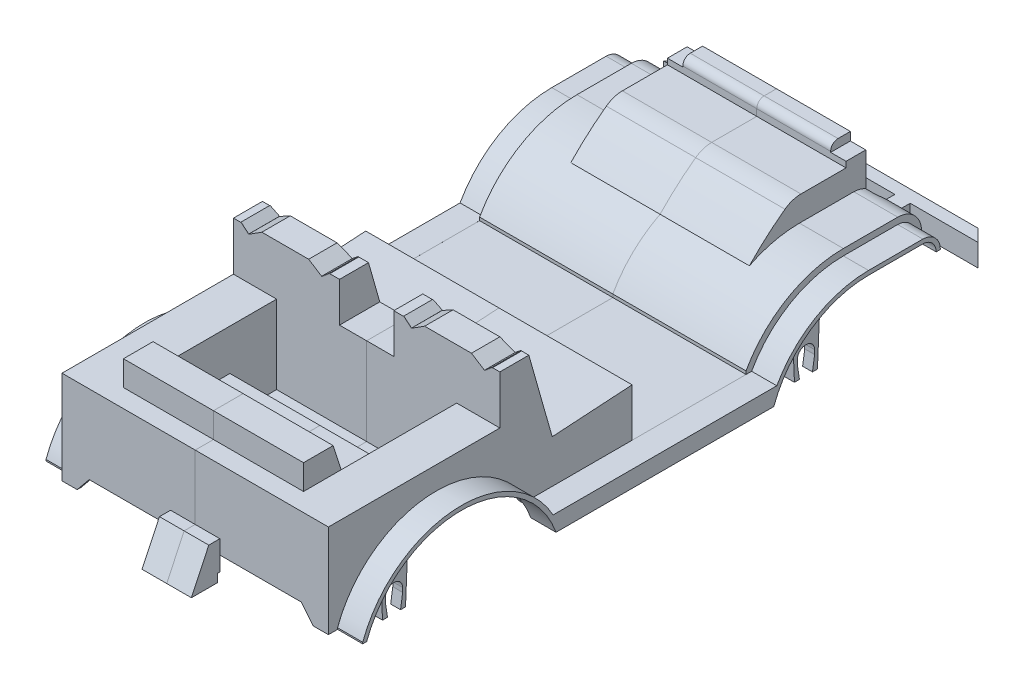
SolidWorks part; units mm, degrees
ref_plane "Alzado" through (0, 0, 0) normal (0, 0, 1) x (1, 0, 0)
ref_plane "Planta" through (0, 0, 0) normal (0, 1, 0) x (1, 0, 0)
ref_plane "Vista lateral" through (0, 0, 0) normal (1, 0, 0) x (0, 0, -1)
sketch "Croquis1" plane through (0, 0, 0) normal (1, 0, 0) x (0, 0, -1)
  line L0 (38.3851, 0) -> (126.683, 0)
  line L1 (165.066, 26.9) -> (186.9727, 26.9011)
  line L3 (-39.983, 0.5802) -> (-39.983, 0)
  line L4 (-39.983, 0) -> (-38.3851, 0)
  line L5 (165.066, 28.6) -> (187.0972, 28.6)
  line L6 (37.1955, 6.7) -> (127.8726, 6.7)
  line L10 (192.474, 21.4) -> (194.174, 21.4)
  arc A0 (-38.3851, 0) -> (38.3851, 0) centre (0, -13.9369) cw
  arc A1 (-39.983, 0.5802) -> (37.1955, 6.7) centre (0, -13.9369) cw
  arc A2 (-39.983, 0.5802) -> (39.983, 0.5802) centre (0, -13.9369) cw construction
  arc A3 (126.683, 0) -> (165.066, 26.9) centre (165.068, -13.9368) cw
  arc A4 (127.8726, 6.7) -> (165.066, 28.6) centre (165.068, -13.9368) cw
  arc A5 (192.474, 21.4) -> (186.9727, 26.9011) centre (186.9729, 21.4) ccw
  arc A6 (194.174, 21.4) -> (187.0972, 28.6) centre (186.9729, 21.4) ccw
  arc A7 (125.0851, 0.5802) -> (205.0509, 0.5802) centre (165.068, -13.9368) cw construction
  arc A8 (194.174, 21.4) -> (186.9726, 28.6011) centre (186.9729, 21.4) ccw construction
  arc A9 (126.683, 0) -> (203.453, 0) centre (165.068, -13.9368) cw construction
  dimension "D1" = 1.7
  dimension "D2" = 1.7
extrude "Extruir1" add sketch "Croquis1" against normal blind 10.2
sketch "Croquis2" plane through (-10.2, 0, 0) normal (-1, 0, 0) x (0, 0, 1)
  line L0 (39.983, 0) -> (43.683, 0)
  line L1 (-79.4171, 6.7) -> (-37.1955, 6.7)
  line L2 (43.683, 0) -> (43.683, 37.8)
  line L3 (43.683, 37.8) -> (-25.817, 37.8)
  line L4 (-25.817, 37.8) -> (-25.817, 58.3)
  line L5 (39.983, 0.5802) -> (39.983, 0) construction
  line L6 (-127.8726, 6.7) -> (-37.1955, 6.7) construction
  line L7 (-79.4171, 6.7) -> (-79.4171, 26.15)
  line L8 (39.983, 0.5802) -> (39.983, 0)
  line L9 (-25.817, 58.3) -> (-37.317, 58.3)
  line L10 (-37.317, 58.3) -> (-47.017, 24.12)
  line L11 (-79.4171, 26.15) -> (-47.017, 24.12)
  arc A0 (39.983, 0.5802) -> (-37.1955, 6.7) centre (0, -13.9369) ccw construction
  arc A1 (39.983, 0.5802) -> (-37.1955, 6.7) centre (0, -13.9369) ccw
sketch "Croquis11" plane through (-10.2, 0, 0) normal (-1, 0, 0) x (0, 0, 1)
  line L20 (-79.4271, 6.69) -> (-79.4271, 26.1606)
  line L21 (-79.4271, 26.1606) -> (-47.0244, 24.1305)
  line L22 (-37.3246, 58.31) -> (-47.0244, 24.1305)
  line L23 (-25.807, 58.31) -> (-37.3246, 58.31)
  line L24 (-25.807, 37.81) -> (-25.807, 58.31)
  line L25 (43.693, 37.81) -> (-25.807, 37.81)
  line L26 (43.693, 6.7) -> (43.693, 37.81)
  line L27 (43.693, -0.01) -> (43.693, 6.7)
  line L28 (39.973, -0.01) -> (43.693, -0.01)
  line L29 (39.973, 0.5784) -> (39.973, -0.01)
  line L30 (-79.4271, 6.69) -> (37.1896, 6.69)
  arc A2 (39.973, 0.5784) -> (37.1896, 6.69) centre (0, -13.9369) ccw
extrude "Extruir14" add sketch "Croquis11" along normal blind 54 separate body
shell "Vaciado4" thickness 1.7
sketch "Croquis14" plane through (-62.5, 0, 0) normal (1, 0, 0) x (0, 0, -1)
  line L10 (-37.1896, 6.69) -> (77.7271, 6.69)
  line L11 (77.7271, 6.69) -> (77.7271, 24.3508)
  line L12 (77.7271, 24.3508) -> (45.7631, 22.3481)
  line L13 (45.7631, 22.3481) -> (36.0399, 56.61)
  line L14 (36.0399, 56.61) -> (27.507, 56.61)
  line L15 (27.507, 56.61) -> (27.507, 36.11)
  line L16 (27.507, 36.11) -> (-41.993, 36.11)
  line L17 (-41.993, 36.11) -> (-41.993, 1.69)
  line L18 (-41.993, 1.69) -> (-41.3741, 1.69)
  line L19 (-39.1222, 6.69) -> (-37.1896, 6.69)
  line L20 (-37.1896, 6.69) -> (77.7271, 6.69)
  line L21 (77.7271, 6.69) -> (77.7271, 24.3508)
  line L22 (77.7271, 24.3508) -> (45.7631, 22.3481)
  line L23 (45.7631, 22.3481) -> (36.0399, 56.61)
  line L24 (36.0399, 56.61) -> (27.507, 56.61)
  line L25 (27.507, 56.61) -> (27.507, 36.11)
  line L26 (27.507, 36.11) -> (-41.993, 36.11)
  line L27 (-41.993, 36.11) -> (-41.993, 1.69)
  line L28 (-41.993, 1.69) -> (-41.3741, 1.69)
  line L29 (-39.1222, 6.69) -> (-37.1896, 6.69)
  arc A1 (-39.1222, 6.69) -> (-41.3741, 1.69) centre (0, -13.9369) ccw
  arc A2 (-39.1222, 6.69) -> (-41.3741, 1.69) centre (0, -13.9369) ccw
  dimension "D1" = 0
extrude "Cortar-Extruir1" cut sketch "Croquis14" against normal blind 54
sketch "Croquis16" plane through (-10.2, 0, 0) normal (1, 0, 0) x (0, 0, -1)
  line L0 (-38.3851, 0) -> (38.3851, 0)
  arc A0 (38.3851, 0) -> (-38.3851, 0) centre (0, -13.9369) ccw construction
  arc A1 (38.3851, 0) -> (-38.3851, 0) centre (0, -13.9369) ccw
extrude "Cortar-Extruir2" cut sketch "Croquis16" against normal blind 54
sketch "Croquis17" plane through (0, 36.11, 0) normal (0, -1, 0) x (1, 0, 0)
  line L4 (-26.9062, 21.973) -> (-64.2, 21.973)
  line L5 (-64.2, 41.993) -> (-64.2, -27.507) construction
  line L6 (-64.2, 21.973) -> (-64.2, -27.507)
  line L7 (-64.2, -27.507) -> (-26.9062, -27.507)
  line L8 (-64.2, -27.507) -> (-11.9, -27.507) construction
  line L9 (-26.9062, -27.507) -> (-26.9062, 21.973)
extrude "Extruir15" add sketch "Croquis17" along normal blind 31
sketch "Croquis18" plane through (-26.9062, 0, 0) normal (1, 0, 0) x (0, 0, -1)
  line L1 (27.507, 5.11) -> (-21.973, 5.11) construction
  line L3 (-21.973, 5.11) -> (-21.973, 36.11) construction
  line L4 (-21.973, 19.4172) -> (5.4562, 19.4172)
  line L5 (5.4562, 19.4172) -> (5.4562, 5.11)
  line L6 (5.4562, 5.11) -> (5.4562, -2.3764)
  line L7 (5.4562, -2.3764) -> (-21.973, -2.3764)
  line L8 (-21.973, 19.4172) -> (-21.973, -2.3764)
extrude "Cortar-Extruir3" cut sketch "Croquis18" against normal blind 70.9148
sketch "Croquis19" plane through (0, 37.81, 0) normal (0, 1, 0) x (-1, 0, 0)
  line L0 (27.9062, -5.4562) -> (64.2, -5.4562)
  line L1 (64.2, -5.4562) -> (64.2, 20.973)
  line L2 (27.9062, 20.973) -> (27.9062, -5.4562)
  line L4 (64.2, 20.973) -> (27.9062, 20.973)
sketch "Croquis20" plane through (-64.2, 0, 0) normal (-1, 0, 0) x (0, 0, 1)
  line L0 (41.993, 1.69) -> (41.993, -0.5673)
  line L1 (41.993, -0.5673) -> (38.166, -0.5673)
  line L2 (38.166, -0.5673) -> (36.4301, -0.5673)
  line L3 (36.4301, -0.5673) -> (36.4301, 9.2353)
  line L4 (36.4301, 9.2353) -> (41.993, 9.2353)
  line L5 (41.993, 1.69) -> (41.993, 36.11) construction
  line L6 (41.993, 9.2353) -> (41.993, 1.69)
  line L7 (-25.807, 37.81) -> (-25.807, 6.0432)
  line L8 (-25.807, 6.0432) -> (-8.6045, 6.0432)
  line L9 (-8.6045, 6.0432) -> (-6.8763, 6.0432)
  line L10 (-6.8763, 6.0432) -> (-6.8763, 19.7607)
  line L11 (-6.8763, 19.7607) -> (-6.8763, 21.1649)
  line L12 (-6.8763, 21.1649) -> (15.5901, 21.1649)
  line L13 (15.5901, 21.1649) -> (20.995, 37.81)
  line L14 (43.693, 37.81) -> (-25.807, 37.81) construction
  line L15 (20.995, 37.81) -> (20.995, 43.4476)
  line L16 (20.995, 43.4476) -> (-25.807, 43.4476)
  line L17 (-25.807, 37.81) -> (-25.807, 58.31) construction
  line L18 (-25.807, 43.4476) -> (-25.807, 37.81)
extrude "Cortar-Extruir6" cut sketch "Croquis20" against normal blind 36.5
sketch "Croquis21" plane through (-27.7, 0, 0) normal (-1, 0, 0) x (0, 0, 1)
  line L5 (41.993, -0.01) -> (41.993, 1.69)
  line L6 (41.993, 1.69) -> (41.3741, 1.69)
  line L7 (39.1222, 6.69) -> (37.1896, 6.69)
  line L8 (39.973, 0.5784) -> (39.973, -0.01)
  line L9 (39.973, -0.01) -> (41.993, -0.01)
  line L10 (41.993, -0.01) -> (41.993, 1.69)
  line L11 (41.993, 1.69) -> (41.3741, 1.69)
  line L12 (39.1222, 6.69) -> (37.1896, 6.69)
  line L13 (39.973, 0.5784) -> (39.973, -0.01)
  line L14 (39.973, -0.01) -> (41.993, -0.01)
  arc A2 (41.3741, 1.69) -> (39.1222, 6.69) centre (0, -13.9369) ccw
  arc A3 (39.973, 0.5784) -> (37.1896, 6.69) centre (0, -13.9369) ccw
  arc A4 (41.3741, 1.69) -> (39.1222, 6.69) centre (0, -13.9369) ccw
  arc A5 (39.973, 0.5784) -> (37.1896, 6.69) centre (0, -13.9369) ccw
  dimension "D1" = 0
extrude "Cortar-Extruir7" cut sketch "Croquis21" against normal up to vertex
sketch "Croquis22" plane through (0, 19.4172, 0) normal (0, -1, 0) x (1, 0, 0)
  line L0 (-26.9062, -5.4562) -> (-26.9062, 6.2438)
  line L1 (-26.9062, -5.4562) -> (-26.9062, 21.973) construction
  line L2 (-26.9062, 6.2438) -> (-30.9062, 6.2438)
  line L3 (-30.9062, 6.2438) -> (-30.9062, -5.4562)
  line L4 (-64.2, -5.4562) -> (-26.9062, -5.4562) construction
  line L5 (-30.9062, -5.4562) -> (-26.9062, -5.4562)
extrude "Extruir16" add sketch "Croquis22" along normal blind 42
sketch "Croquis23" plane through (0, 19.4172, 0) normal (0, -1, 0) x (1, 0, 0)
  line L0 (-30.9062, -0.7328) -> (-30.9062, 1.5203)
  line L1 (-30.9062, 6.2438) -> (-30.9062, -5.4562) construction
  line L3 (-38.0913, 1.5203) -> (-30.9062, 1.5203)
  line L6 (-38.0913, -0.7328) -> (-30.9062, -0.7328)
  arc A0 (-38.0913, 1.5203) -> (-38.0913, -0.7328) centre (-41.4265, 0.3938) ccw
extrude "Extruir17" add sketch "Croquis23" along normal up to vertex
sketch "Croquis24" plane through (0, 5.11, 0) normal (0, -1, 0) x (1, 0, 0)
  line L0 (-38.0913, -0.7328) -> (-30.9062, -0.7328) construction
  line L1 (-38.0913, -0.7328) -> (-30.9062, -0.7328)
  line L2 (-30.9062, 1.5203) -> (-38.0913, 1.5203) construction
  line L3 (-30.9062, 1.5203) -> (-38.0913, 1.5203)
  line L4 (-30.9062, -0.7328) -> (-30.9062, 1.5203)
  arc A0 (-38.0913, 1.5203) -> (-38.0913, -0.7328) centre (-37.7548, 0.3938) ccw
extrude "Extruir18" add sketch "Croquis24" along normal blind 9
sketch "Croquis25" plane through (-26.9062, 0, 0) normal (1, 0, 0) x (0, 0, -1)
  line L0 (4.2703, -22.5828) -> (5.4562, 5.11)
  line L1 (5.4562, -22.5828) -> (-6.2438, -22.5828) construction
  line L2 (-3.8938, -16.9222) -> (-3.037, -22.5828)
  line L3 (-5.0579, -22.5828) -> (-6.2438, 5.11)
  line L4 (5.4562, 5.11) -> (10.7771, -24.2142)
  line L5 (10.7771, -24.2142) -> (4.8633, -25.2872)
  line L6 (4.8633, -25.2872) -> (4.2703, -22.5828)
  line L7 (-6.2438, 5.11) -> (-11.6061, -25.2872)
  line L8 (-11.6061, -25.2872) -> (-6.2438, -25.2872)
  line L9 (-6.2438, -25.2872) -> (-5.0579, -22.5828)
  line L11 (3.1062, -15.1828) -> (3.1062, -16.9222)
  line L12 (-3.8938, -15.1828) -> (-3.8938, -16.9222)
  line L13 (-3.037, -23.3879) -> (2.2494, -23.3879)
  line L15 (3.1062, -16.9222) -> (2.2494, -22.5828)
  line L16 (2.2494, -22.5828) -> (2.2494, -23.3879)
  line L17 (-3.037, -22.5828) -> (-3.037, -23.3879)
  arc A0 (3.1062, -15.1828) -> (-3.8938, -15.1828) centre (-0.3938, -15.1828) ccw
extrude "Cortar-Extruir8" cut sketch "Croquis25" against normal blind 9
sketch "Croquis26" plane through (0, 19.4047, 1.2158) normal (0, -0.998, -0.0625) x (1, 0, 0)
  line L2 (-41.2, -63.0844) -> (-41.2, -77.9934)
  line L3 (-64.2, -77.9934) -> (-11.9, -77.9934) construction
  line L4 (-41.2, -77.9934) -> (-64.2, -77.9934)
  line L5 (-64.2, -77.9934) -> (-64.2, -27.7727)
  line L6 (-64.2, -27.7727) -> (-41.2, -27.7727)
  line L7 (-64.2, -27.7727) -> (-26.9062, -27.7727) construction
  line L8 (-41.2, -27.7727) -> (-41.2, -63.0844)
sketch "Croquis27" plane through (-64.2, 0, 0) normal (-1, 0, 0) x (0, 0, 1)
  line L0 (-45.7631, 22.3481) -> (-27.507, 22.3481)
  line L1 (-27.507, 5.11) -> (-27.507, 56.61) construction
  line L2 (-27.507, 22.3481) -> (-27.507, 56.61)
  line L3 (-27.507, 56.61) -> (-36.0399, 56.61)
  line L4 (-36.0399, 56.61) -> (-45.7631, 22.3481)
extrude "Extruir21" add sketch "Croquis27" against normal blind 11.1
sketch "Croquis28" plane through (0, 22.3481, 0) normal (0, -1, 0) x (1, 0, 0)
  line L0 (-64.2, -27.507) -> (-64.2, -28.4123)
  line L1 (-64.2, -45.7631) -> (-64.2, -27.507) construction
  line L2 (-64.2, -28.4123) -> (-53.1, -28.4123)
  line L3 (-53.1, -45.7631) -> (-53.1, -27.507) construction
  line L4 (-53.1, -28.4123) -> (-53.1, -27.507)
  line L5 (-64.2, -27.507) -> (-26.9062, -27.507) construction
  line L6 (-53.1, -27.507) -> (-64.2, -27.507)
extrude "Extruir22" add sketch "Croquis28" along normal up to vertex
sketch "Croquis29" plane through (-64.2, 0, 0) normal (-1, 0, 0) x (0, 0, 1)
  line L0 (20.995, 37.81) -> (36.2862, 37.81)
  line L1 (43.693, 37.81) -> (20.995, 37.81) construction
  line L2 (20.995, 37.81) -> (24.2805, 47.9281)
  line L3 (24.2805, 47.9281) -> (36.2862, 47.9281)
  line L4 (36.2862, 47.9281) -> (36.2862, 37.81)
extrude "Extruir23" add sketch "Croquis29" against normal up to vertex
sketch "Croquis31" plane through (-64.2, 0, 0) normal (-1, 0, 0) x (0, 0, 1)
  line L3 (16.5412, 20.856) -> (25.2316, 47.6193)
  line L4 (16.5412, 20.856) -> (25.0071, 46.9281)
  line L6 (36.2862, 46.9281) -> (24.2805, 46.9281)
  line L7 (35.2862, 46.9281) -> (25.0071, 46.9281)
  line L9 (35.2862, 37.81) -> (35.2862, 47.9281)
  line L10 (35.2862, 37.81) -> (35.2862, 46.9281)
  line L11 (35.2862, 20.856) -> (35.2862, 37.81)
  line L12 (16.5412, 20.856) -> (16.5412, 17.8954)
  line L13 (16.5412, 17.8954) -> (35.2862, 17.8954)
  line L14 (35.2862, 17.8954) -> (35.2862, 20.856)
  dimension "D1" = 1
  dimension "D2" = 1
  dimension "D3" = 1
extrude "Cortar-Extruir9" cut sketch "Croquis31" against normal blind 36.0957
sketch "Croquis32" plane through (-28.1043, 0, 0) normal (-1, 0, 0) x (0, 0, 1)
  line L0 (21.973, 36.11) -> (21.4944, 36.11)
  line L1 (25.0071, 46.9281) -> (16.5412, 20.856) construction
  line L2 (21.4944, 36.11) -> (16.5412, 20.856)
  line L3 (16.5412, 20.856) -> (16.5412, 19.4172) construction
  line L4 (16.5412, 20.856) -> (16.5412, 18.2909)
  line L5 (16.5412, 18.2909) -> (21.973, 18.2909)
  line L6 (21.973, 18.2909) -> (21.973, 36.11)
extrude "Cortar-Extruir10" cut sketch "Croquis32" against normal blind 7.1
sketch "Croquis33" plane through (-10.2, 0, 0) normal (-1, 0, 0) x (0, 0, 1)
  line L0 (-79.4271, 6.69) -> (-79.4271, 6.0743)
  line L1 (-79.4271, 6.0743) -> (-127.8726, 6.0743)
  line L2 (-127.8726, 6.0743) -> (-127.8726, 6.7)
  line L3 (-127.8726, 6.7) -> (-79.4271, 6.69)
extrude "Extruir25" add sketch "Croquis33" along normal up to vertex separate body
sketch "Croquis34" plane through (0, 6.0743, 0) normal (0, -1, 0) x (1, 0, 0)
  line L0 (-52.0158, -77.7271) -> (-52.0158, -76.7271)
  line L1 (-64.2, -77.7271) -> (-11.9, -77.7271) construction
  line L2 (-52.0158, -76.7271) -> (-56.7006, -76.7271)
  line L3 (-56.7006, -76.7271) -> (-56.7006, -77.7271)
  line L4 (-56.7006, -77.7271) -> (-52.0158, -77.7271)
extrude "Extruir26" add sketch "Croquis34" against normal up to vertex
sketch "Croquis35" plane through (-10.2, 0, 0) normal (-1, 0, 0) x (0, 0, 1)
  line L0 (-127.8726, 6.0743) -> (-129.4703, 6.0743)
  line L1 (-127.8726, 6.0743) -> (-127.8726, 6.7)
  line L2 (-187.0972, 28.6) -> (-165.066, 28.6) construction
  line L3 (-187.0972, 28.6) -> (-165.066, 28.6)
  line L4 (-192.474, 21.4) -> (-194.174, 21.4) construction
  line L5 (-192.474, 21.4) -> (-194.174, 21.4)
  line L6 (-165.066, 26.9) -> (-186.9727, 26.9011) construction
  line L7 (-165.066, 26.9) -> (-186.9727, 26.9011)
  arc A0 (-127.8726, 6.7) -> (-165.066, 28.6) centre (-165.068, -13.9368) ccw construction
  arc A1 (-127.8726, 6.7) -> (-165.066, 28.6) centre (-165.068, -13.9368) ccw
  arc A2 (-187.0972, 28.6) -> (-194.174, 21.4) centre (-186.9729, 21.4) ccw construction
  arc A3 (-187.0972, 28.6) -> (-194.174, 21.4) centre (-186.9729, 21.4) ccw
  arc A4 (-186.9727, 26.9011) -> (-192.474, 21.4) centre (-186.9729, 21.4) ccw construction
  arc A5 (-186.9727, 26.9011) -> (-192.474, 21.4) centre (-186.9729, 21.4) ccw
  arc A7 (-126.683, 0) -> (-165.066, 26.9) centre (-165.068, -13.9368) ccw construction
  arc A8 (-129.4703, 6.0743) -> (-165.066, 26.9) centre (-165.068, -13.9368) ccw
extrude "Extruir27" add sketch "Croquis35" along normal up to vertex
sketch "Croquis36" plane through (-64.2, 0, 0) normal (-1, 0, 0) x (0, 0, 1)
  line L0 (-165.066, 28.6) -> (-187.0972, 28.6) construction
  line L1 (-165.066, 28.6) -> (-187.0972, 28.6)
  line L2 (-165.0659, 31.2) -> (-187.1179, 31.2)
  line L3 (-196.774, 21.4) -> (-194.174, 21.4)
  line L4 (-125.599, 7.9614) -> (-125.599, 6.6995)
  line L5 (-79.4271, 6.69) -> (-127.8726, 6.7) construction
  line L6 (-127.8726, 6.7) -> (-125.599, 6.6995)
  arc A0 (-187.0972, 28.6) -> (-194.174, 21.4) centre (-186.9729, 21.4) ccw construction
  arc A1 (-187.0972, 28.6) -> (-194.174, 21.4) centre (-186.9729, 21.4) ccw
  arc A2 (-127.8726, 6.7) -> (-165.066, 28.6) centre (-165.068, -13.9368) ccw construction
  arc A3 (-127.8726, 6.7) -> (-165.066, 28.6) centre (-165.068, -13.9368) ccw
  arc A4 (-125.599, 7.9614) -> (-165.0659, 31.2) centre (-165.068, -13.9368) ccw
  arc A5 (-187.1179, 31.2) -> (-196.774, 21.4) centre (-186.9729, 21.4) ccw
  dimension "D1" = 2.6
extrude "Extruir28" add sketch "Croquis36" against normal up to vertex
sketch "Croquis37" plane through (0, 31.2, 0) normal (0, 1, 0) x (-1, 0, 0)
  line L1 (10.2, -196.774) -> (64.2, -196.774) construction
  line L2 (20.8, -196.774) -> (20.8, -195.9459)
  line L3 (24.8, -191.9459) -> (69.817, -191.9459)
  line L4 (69.817, -191.9459) -> (69.817, -201.0517)
  line L5 (69.817, -201.0517) -> (20.8, -201.0517)
  line L6 (20.8, -201.0517) -> (20.8, -196.774)
  arc A0 (24.8, -191.9459) -> (20.8, -195.9459) centre (24.8, -195.9459) ccw
  dimension "D1" = 4
extrude "Cortar-Extruir11" cut sketch "Croquis37" against normal blind 50.1
ref_plane "Plano1" through (-28, 0, 0) normal (1, 0, 0) x (0, 0, -1)
sketch "Croquis38" plane through (-28, 0, 0) normal (1, 0, 0) x (0, 0, -1)
  line L0 (191.9459, 29.8457) -> (191.9459, 46.8457)
  line L1 (191.9459, 46.8457) -> (183.9459, 46.8457)
  line L2 (183.9459, 46.8457) -> (183.9459, 41.1457)
  line L3 (183.9459, 41.1457) -> (165.6743, 41.1457)
  line L4 (165.0659, 31.2) -> (187.1179, 31.2) construction
  line L5 (165.0659, 31.2) -> (187.1179, 31.2)
  arc A0 (165.0659, 31.2) -> (125.599, 7.9614) centre (165.068, -13.9368) ccw construction
  arc A2 (144.7602, 26.3735) -> (159.1918, 39.0327) centre (222.2299, -47.3877) cw
  arc A3 (165.6743, 41.1457) -> (159.1918, 39.0327) centre (165.6743, 30.1457) ccw
  arc A4 (165.0659, 31.2) -> (144.7602, 26.3735) centre (165.068, -13.9368) ccw
  arc A5 (196.774, 21.4) -> (187.1179, 31.2) centre (186.9729, 21.4) ccw construction
  arc A6 (191.9459, 29.8457) -> (187.1179, 31.2) centre (186.9729, 21.4) ccw
  dimension "D1" = 11
extrude "Extruir29" add sketch "Croquis38" against normal up to vertex
fillet "Redondeo1" radius 3 1 edges at (-46.1, 46.8457, -183.9459)
sketch "Croquis39" plane through (0, 0, -191.9459) normal (0, 0, -1) x (-1, 0, 0)
  line L0 (28, 46.8457) -> (28, 43.4827)
  line L1 (28, 29.8457) -> (28, 46.8457) construction
  line L2 (28, 43.4827) -> (34.2452, 43.4827)
  line L3 (34.2452, 43.4827) -> (34.2452, 47.68)
  line L4 (34.2452, 47.68) -> (32.5, 47.68)
  line L5 (32.5, 47.68) -> (28, 46.8457)
extrude "Cortar-Extruir12" cut sketch "Croquis39" against normal blind 10
sketch "Croquis40" plane through (0, 0, -191.9459) normal (0, 0, -1) x (-1, 0, 0)
  line L0 (28, 23.7518) -> (28, 6.7518)
  line L1 (24.8, 23.7518) -> (64.2, 23.7518) construction
  line L2 (28, 6.7518) -> (64.2, 6.7518)
  line L3 (64.2, 23.7518) -> (64.2, 6.7518)
  line L4 (64.2, 23.7518) -> (28, 23.7518)
extrude "Extruir30" add sketch "Croquis40" against normal blind 1.7
sketch "Croquis41" plane through (0, 0, -191.9459) normal (0, 0, -1) x (-1, 0, 0)
  line L0 (28, 6.7518) -> (28, 15.7518)
  line L1 (28, 23.7518) -> (28, 6.7518) construction
  line L2 (28, 15.7518) -> (64.2039, 15.7518)
  line L4 (28, 6.7518) -> (64.2, 6.7518)
  line L5 (64.2, 6.7518) -> (64.2039, 15.7518)
extrude "Extruir31" add sketch "Croquis41" along normal blind 23
sketch "Croquis42" plane through (0, 15.7518, 0) normal (0, 1, 0) x (-1, 0, 0)
  line L1 (64.2039, -209.9459) -> (65.1829, -209.9459)
  line L2 (64.2039, -209.9459) -> (28, -209.9459)
  line L3 (34.2, -191.9459) -> (65.1829, -191.9459)
  line L4 (65.1829, -191.9459) -> (65.1829, -209.9459)
  line L5 (64.2039, -209.9459) -> (34.2, -209.9459)
  line L8 (34.2, -209.9459) -> (34.2, -191.9459)
  dimension "D1" = 5
extrude "Cortar-Extruir13" cut sketch "Croquis42" against normal blind 8
sketch "Croquis43" plane through (-64.197, -0.0281, 0) normal (-1, -0.0004, 0) x (0, 0, 1)
  line L0 (-209.9459, 7.7799) -> (-191.9459, 7.7799) construction
  line L1 (-195.9459, 7.7799) -> (-205.9459, 7.7799)
  arc A0 (-195.9459, 7.7799) -> (-205.9459, 7.7799) centre (-200.9459, 7.7799) ccw
extrude "Extruir32" add sketch "Croquis43" against normal blind 22
sketch "Croquis44" plane through (-28, 0, 0) normal (1, 0, 0) x (0, 0, -1)
  line L0 (209.9459, 15.7518) -> (209.9459, 6.7518)
  line L1 (190.2459, 6.7518) -> (214.9459, 6.7518) construction
  line L2 (209.9459, 6.7518) -> (214.9459, 6.7518)
  line L3 (214.9459, 6.7518) -> (214.9459, 15.7518)
  line L4 (214.9459, 15.7518) -> (209.9459, 15.7518)
extrude "Extruir33" add sketch "Croquis44" along normal blind 27.5
chamfer "Chaflán1" distance 5 angle 45 3 edges at (-0.5, 15.7518, -212.4459) (-0.5, 6.7518, -212.4459) (-0.5, 11.2518, -214.9459)
sketch "Croquis45" plane through (0, 0, -25.807) normal (0, 0, 1) x (1, 0, 0)
  line L2 (-52.2, 68.929) -> (-52.2, 61.4285)
  line L3 (-52.2, 41.429) -> (-75.7153, 41.429)
  line L4 (-75.7153, 41.429) -> (-75.7153, 68.929)
  line L5 (-75.7153, 68.929) -> (-52.2, 68.929)
  line L6 (-13.1506, 57.5006) -> (-16.2738, 54.8564)
  line L7 (-16.2738, 54.8564) -> (-21.7128, 58.31)
  line L8 (-31.2, 58.31) -> (-31.2, 62.5616) construction
  line L9 (-13.1506, 57.5006) -> (-9.2485, 57.5006)
  line L10 (-9.2485, 57.5006) -> (-9.2485, 61.4285)
  line L11 (-9.2485, 61.4285) -> (-21.7128, 61.4285)
  line L12 (-21.7128, 61.4285) -> (-21.7128, 58.31)
  line L13 (-40.6872, 61.4285) -> (-40.6872, 58.31)
  line L14 (-52.2, 61.4285) -> (-40.6872, 61.4285)
  line L16 (-49.2494, 57.5006) -> (-52.2, 57.5006)
  line L17 (-46.1262, 54.8564) -> (-40.6872, 58.31)
  line L18 (-49.2494, 57.5006) -> (-46.1262, 54.8564)
  line L19 (-52.2, 57.5006) -> (-52.2, 41.429)
extrude "Cortar-Extruir14" cut sketch "Croquis45" against normal blind 27.5
sketch "Croquis46" plane through (-52.2, 0, 0) normal (-1, 0, 0) x (0, 0, 1)
  line L0 (-37.5543, 57.5006) -> (-25.807, 57.5006) construction
  line L1 (-37.5543, 57.5006) -> (-25.807, 57.5006)
  line L2 (-25.807, 41.429) -> (-25.807, 57.5006) construction
  line L3 (-25.807, 41.429) -> (-25.807, 57.5006)
  line L4 (-42.1152, 41.429) -> (-37.5543, 57.5006) construction
  line L5 (-42.1152, 41.429) -> (-37.5543, 57.5006)
  line L6 (-25.807, 41.429) -> (-42.1152, 41.429)
extrude "Extruir34" add sketch "Croquis46" along normal blind 1
sketch "Croquis47" plane through (-38.0774, 59.9672, 0) normal (-0.536, 0.8442, 0) x (-0.8442, -0.536, 0)
  line L0 (9.5344, -36.5375) -> (9.5344, -27.507)
  line L8 (6.263, -27.507) -> (9.5344, -27.507)
  line L9 (9.5344, -27.507) -> (9.5344, -25.807)
  line L10 (9.5344, -25.807) -> (3.0916, -25.807)
  line L11 (3.0916, -25.807) -> (3.0916, -37.3246)
  line L12 (3.0916, -37.3246) -> (9.5344, -38.3047)
  line L13 (9.5344, -38.3047) -> (9.5344, -36.5375)
  line L14 (9.5344, -36.5375) -> (6.263, -36.0399)
  line L15 (6.263, -36.0399) -> (6.263, -27.507)
  line L17 (9.5344, -27.507) -> (9.5344, -25.807)
  line L18 (9.5344, -25.807) -> (3.0916, -25.807)
  line L19 (3.0916, -25.807) -> (3.0916, -37.3246)
  line L20 (3.0916, -37.3246) -> (9.5344, -38.3047)
  line L21 (9.5344, -38.3047) -> (9.5344, -36.5375)
  dimension "D1" = 0
extrude "Extruir35" add sketch "Croquis47" against normal blind 1
sketch "Croquis48" plane through (7.7941, 9.2061, 0) normal (0.6462, 0.7632, 0) x (-0.7632, 0.6462, 0)
  line L0 (70.6495, -36.5375) -> (70.6495, -27.507)
  line L8 (70.6495, -27.507) -> (73.3634, -27.507)
  line L9 (73.3634, -27.507) -> (73.3634, -36.0399)
  line L10 (73.3634, -36.0399) -> (70.6495, -36.5375)
  line L11 (70.6495, -36.5375) -> (70.6495, -38.3047)
  line L12 (70.6495, -38.3047) -> (74.7417, -37.5543)
  line L13 (74.7417, -37.5543) -> (74.7417, -25.807)
  line L14 (74.7417, -25.807) -> (70.6495, -25.807)
  line L15 (70.6495, -25.807) -> (70.6495, -27.507)
  line L19 (70.6495, -36.5375) -> (70.6495, -38.3047)
  line L20 (70.6495, -38.3047) -> (74.7417, -37.5543)
  line L21 (74.7417, -37.5543) -> (74.7417, -25.807)
  line L22 (74.7417, -25.807) -> (70.6495, -25.807)
  line L23 (70.6495, -25.807) -> (70.6495, -27.507)
  dimension "D1" = 0
sketch "Croquis49" plane through (20.1476, 31.73, 0) normal (0.536, 0.8442, 0) x (-0.8442, 0.536, 0)
  line L0 (43.1433, -36.5375) -> (43.1433, -27.507)
  line L8 (43.1433, -27.507) -> (46.4147, -27.507)
  line L9 (46.4147, -27.507) -> (46.4147, -36.0399)
  line L10 (46.4147, -36.0399) -> (43.1433, -36.5375)
  line L11 (43.1433, -36.5375) -> (43.1433, -38.3047)
  line L12 (43.1433, -38.3047) -> (49.5861, -37.3246)
  line L13 (49.5861, -37.3246) -> (49.5861, -25.807)
  line L14 (49.5861, -25.807) -> (43.1433, -25.807)
  line L15 (43.1433, -25.807) -> (43.1433, -27.507)
  line L19 (43.1433, -36.5375) -> (43.1433, -38.3047)
  line L20 (43.1433, -38.3047) -> (49.5861, -37.3246)
  line L21 (49.5861, -37.3246) -> (49.5861, -25.807)
  line L22 (49.5861, -25.807) -> (43.1433, -25.807)
  line L23 (43.1433, -25.807) -> (43.1433, -27.507)
  dimension "D1" = 0
extrude "Extruir39" add sketch "Croquis49" against normal blind 0.2
sketch "Croquis50" plane through (-33.8469, 39.9786, 0) normal (-0.6462, 0.7632, 0) x (-0.7632, -0.6462, 0)
  line L0 (-23.0253, -27.507) -> (-23.0253, -36.5375)
  line L8 (-25.7392, -27.507) -> (-23.0253, -27.507)
  line L9 (-23.0253, -27.507) -> (-23.0253, -25.807)
  line L10 (-23.0253, -25.807) -> (-27.1175, -25.807)
  line L11 (-27.1175, -25.807) -> (-27.1175, -37.5543)
  line L12 (-27.1175, -37.5543) -> (-23.0253, -38.3047)
  line L13 (-23.0253, -38.3047) -> (-23.0253, -36.5375)
  line L14 (-23.0253, -36.5375) -> (-25.7392, -36.0399)
  line L15 (-25.7392, -36.0399) -> (-25.7392, -27.507)
  line L17 (-23.0253, -27.507) -> (-23.0253, -25.807)
  line L18 (-23.0253, -25.807) -> (-27.1175, -25.807)
  line L19 (-27.1175, -25.807) -> (-27.1175, -37.5543)
  line L20 (-27.1175, -37.5543) -> (-23.0253, -38.3047)
  line L21 (-23.0253, -38.3047) -> (-23.0253, -36.5375)
  dimension "D1" = 0
extrude "Extruir41" add sketch "Croquis50" along normal blind 0.2 separate body
extrude "Extruir43" add sketch "Croquis48" along normal blind 0.2 separate body
sketch "Croquis51" plane through (-26.9062, 0, 0) normal (1, 0, 0) x (0, 0, -1)
  line L19 (172.4562, 19.4172) -> (172.4562, 26.9004)
  line L20 (160.7562, 5.11) -> (161.9421, -22.5828)
  line L21 (161.9421, -22.5828) -> (163.963, -22.5828)
  line L22 (163.963, -22.5828) -> (163.1062, -16.9222)
  line L23 (163.1062, -16.9222) -> (163.1062, -15.1828)
  line L24 (170.1062, -15.1828) -> (170.1062, -16.9222)
  line L25 (170.1062, -16.9222) -> (169.2494, -22.5828)
  line L26 (169.2494, -22.5828) -> (171.2703, -22.5828)
  line L27 (171.2703, -22.5828) -> (172.4562, 5.11)
  line L28 (172.4562, 5.11) -> (172.4562, 19.4172)
  line L29 (165.066, 26.9) -> (186.9727, 26.9011) construction
  line L30 (160.7562, 5.11) -> (160.7562, 26.6717)
  line L31 (165.066, 26.9) -> (172.4562, 26.9004)
  arc A2 (163.1062, -15.1828) -> (170.1062, -15.1828) centre (166.6062, -15.1828) cw
  arc A3 (165.066, 26.9) -> (126.683, 0) centre (165.068, -13.9368) ccw construction
  arc A4 (165.066, 26.9) -> (160.7562, 26.6717) centre (165.068, -13.9368) ccw
extrude "Extruir44" add sketch "Croquis51" against normal up to vertex
sketch "Croquis52" plane through (0, 26.8919, 0.0013) normal (0, -1, 0) x (1, 0, 0)
  line L0 (-30.9062, -160.7565) -> (-30.9062, -150.2929)
  line L1 (-30.9062, -150.2929) -> (-67.1479, -150.2929)
  line L2 (-67.1479, -150.2929) -> (-67.1479, -190.2463)
  line L3 (-67.1479, -190.2463) -> (-30.9062, -190.2463)
  line L4 (-30.9062, -190.2463) -> (-30.9062, -160.7565)
sketch "Croquis53" plane through (-64.2, 0, 0) normal (-1, 0, 0) x (0, 0, 1)
  line L0 (-190.2459, 23.7518) -> (-190.2459, 28.9)
  line L1 (-190.2459, 28.9) -> (-190.2459, 41.1457)
  line L2 (-190.2459, 41.1457) -> (-185.4858, 41.1457)
  line L4 (-185.4858, 41.1457) -> (-185.4762, 39.1683)
  line L5 (-133.7465, 7.0252) -> (-190.2459, 6.7518)
  line L6 (-190.2459, 6.7518) -> (-190.2459, 23.7518)
  line L7 (-185.4762, 39.1683) -> (-168.4976, 39.1683)
  arc A2 (-162.0878, 37.1078) -> (-133.7465, 7.0252) centre (-224.8292, -50.3936) cw
  arc A3 (-168.4976, 39.1683) -> (-162.0878, 37.1078) centre (-168.4976, 28.1683) cw
  dimension "D1" = 11
extrude "Cortar-Extruir16" cut sketch "Croquis53" against normal up to vertex
sketch "Croquis55" plane through (-64.2, 0, 0) normal (-1, 0, 0) x (0, 0, 1)
  line L0 (-190.2459, 23.7518) -> (-191.9459, 23.7518) construction
  line L1 (-190.2459, 23.7518) -> (-191.9459, 23.7518)
  line L2 (-190.2459, 25.8214) -> (-190.2459, 23.7518)
  arc A0 (-190.2459, 25.8214) -> (-191.9459, 23.7518) centre (-186.9729, 21.4) ccw construction
  arc A1 (-190.2459, 25.8214) -> (-191.9459, 23.7518) centre (-186.9729, 21.4) ccw
extrude "Extruir47" add sketch "Croquis55" against normal up to vertex
sketch "Croquis56" plane through (0, 0, 43.693) normal (0, 0, 1) x (1, 0, 0)
  line L1 (-64.2, -0.01) -> (-10.2, -0.01) construction
  line L2 (-16.343, -0.01) -> (-21.2208, 5.9505)
  line L3 (-21.2208, 5.9505) -> (-71.4995, 5.9505)
  line L4 (-71.4995, 5.9505) -> (-71.4995, -0.01)
  line L5 (-71.4995, -0.01) -> (-66.6217, -10.9341)
  line L6 (-66.6217, -10.9341) -> (-16.343, -10.9341)
  line L7 (-16.343, -10.9341) -> (-16.343, -0.01)
extrude "Cortar-Extruir17" cut sketch "Croquis56" against normal blind 10
sketch "Croquis57" plane through (-64.2, 0, 0) normal (-1, 0, 0) x (0, 0, 1)
  line L0 (43.693, 11.6929) -> (48.1946, 11.6929)
  line L1 (43.693, 5.9505) -> (43.693, 37.81) construction
  line L2 (48.1946, 11.6929) -> (55.2382, -3.2747)
  line L3 (55.2382, -3.2747) -> (44.6728, -3.2747)
  line L4 (44.6728, -3.2747) -> (44.6728, 0)
  line L5 (44.6728, 0) -> (43.693, -0.01)
  line L6 (43.693, -0.01) -> (43.693, 11.6929)
extrude "Extruir48" add sketch "Croquis57" against normal blind 10 separate body
mirror "Simetría1" about plane through (-64.2, -13.9369, 0) normal (-1, 0, 0)
